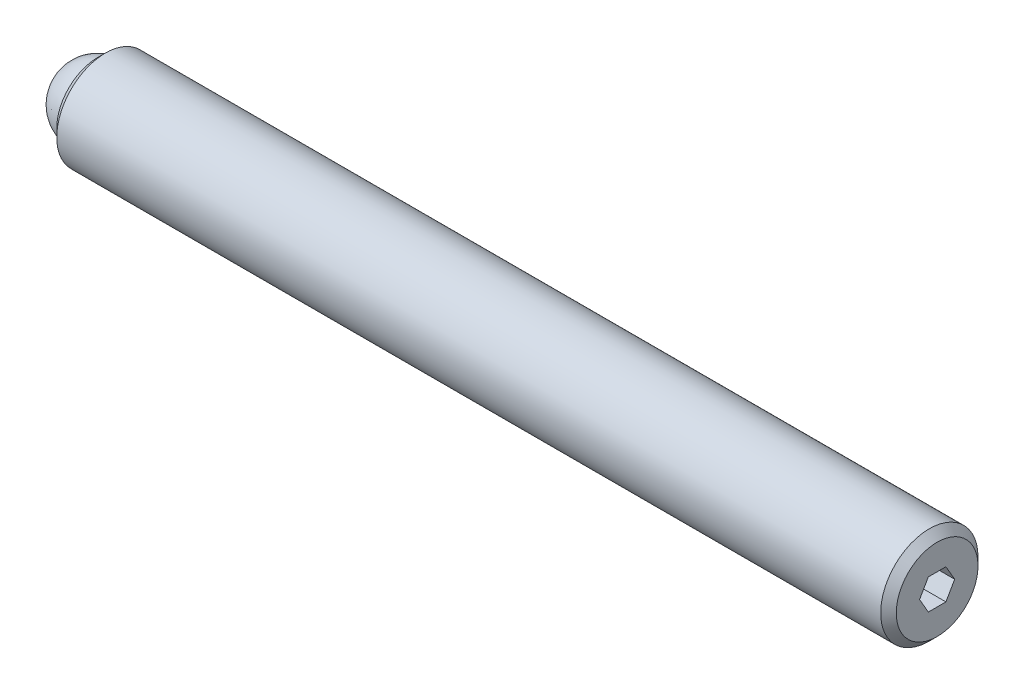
SolidWorks part; units mm, degrees
ref_plane "Front Plane" through (0, 0, 0) normal (0, 0, 1) x (1, 0, 0)
ref_plane "Top Plane" through (0, 0, 0) normal (0, 1, 0) x (1, 0, 0)
ref_plane "Right Plane" through (0, 0, 0) normal (1, 0, 0) x (0, 0, -1)
sketch "Sketch2" plane through (0, 0, 0) normal (1, 0, 0) x (0, 0, -1)
  circle A0 centre (0, 0) radius 3.175
  dimension "D1" = 6.35
extrude "Boss-Extrude1" add sketch "Sketch2" along normal blind 54.7687
sketch "Sketch3" plane through (0, 0, 0) normal (-1, 0, 0) x (0, 0, 1)
  circle A0 centre (0, 0) radius 2.3813
  dimension "D1" = 4.7625
chamfer "Chamfer1" distance 0.508 angle 45 1 edges at (0, 0, -3.175)
chamfer "Chamfer2" distance 0.508 angle 45 1 edges at (54.7687, 0, -3.175)
sketch "Sketch4" plane through (54.7687, 0, 0) normal (1, 0, 0) x (0, 0, -1)
  line L1 (1.1457, 0) -> (0.5728, 0.9922)
  line L2 (0.5728, 0.9922) -> (-0.5728, 0.9922)
  line L3 (-0.5728, 0.9922) -> (-1.1457, 0)
  line L4 (-1.1457, 0) -> (-0.5728, -0.9922)
  line L5 (-0.5728, -0.9922) -> (0.5728, -0.9922)
  line L6 (0.5728, -0.9922) -> (1.1457, 0)
  circle A0 centre (0, 0) radius 0.9922 construction
  dimension "D1" = 1.9844
extrude "Cut-Extrude2" cut sketch "Sketch4" against normal blind 2.286
extrude "Cut-Extrude3" cut sketch "Sketch3" against normal blind 1.9844
sketch "Sketch5" plane through (0, 0, 0) normal (-1, 0, 0) x (0, 0, 1)
  line L0 (0, 0) -> (0, -2.3813)
  line L1 (0, 0) -> (0, 2.3813)
  arc A0 (0, 2.3813) -> (0, -2.3813) centre (0, 0) ccw
  dimension "D1" = 2.3813
revolve "Revolve1" add sketch "Sketch5" angle 360 about L1
